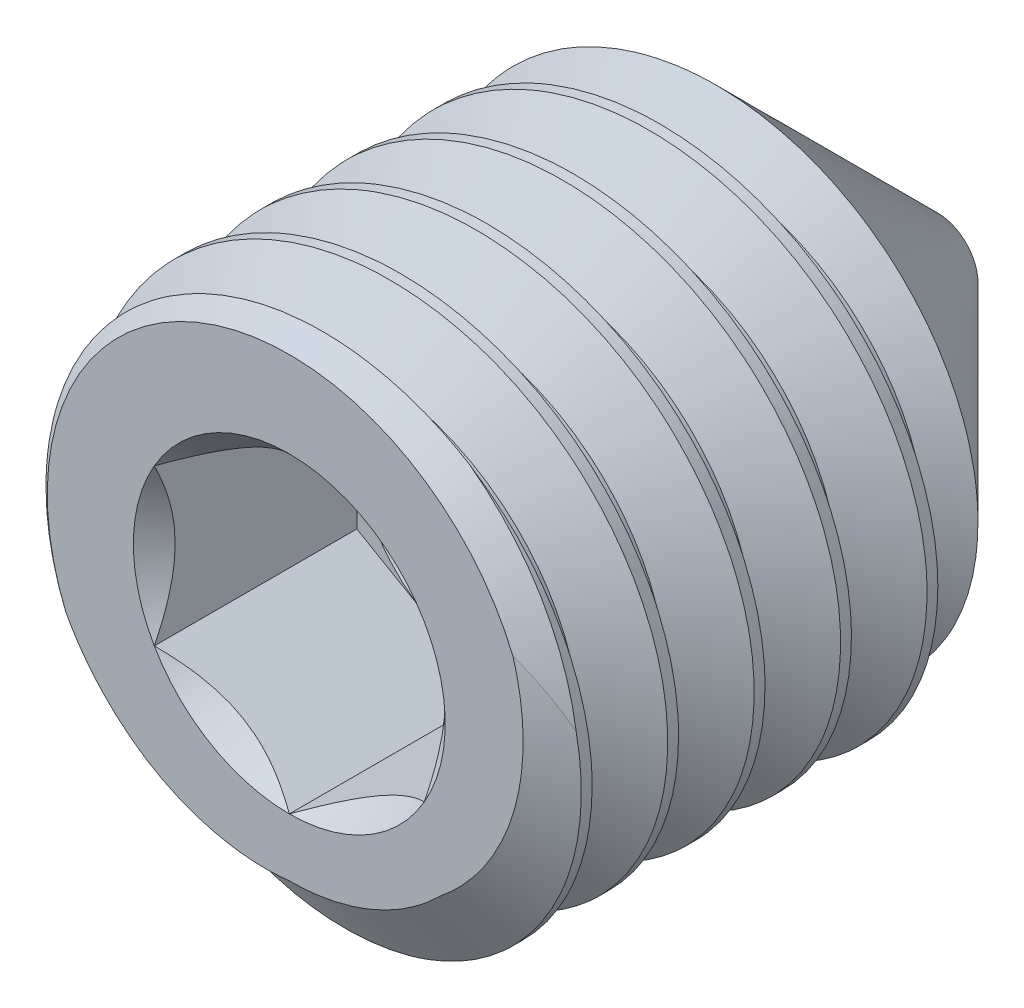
SolidWorks part; units mm, degrees
ref_plane "Front Plane" through (0, 0, 0) normal (0, 0, 1) x (1, 0, 0)
ref_plane "Top Plane" through (0, 0, 0) normal (0, 1, 0) x (1, 0, 0)
ref_plane "Right Plane" through (0, 0, 0) normal (1, 0, 0) x (0, 0, -1)
sketch "Sketch1" plane through (0, 0, 0) normal (1, 0, 0) x (0, 0, -1)
  line L0 (3, 0) -> (-3, 0) construction
  line L1 (0, -2.5) -> (0, 2.5) construction
  line L2 (3, 2.5) -> (-3, 2.5) construction
  line L3 (-3, 2.5) -> (-3, 0) construction
  line L4 (3, 0) -> (3, 2.5) construction
  line L5 (-3, -1.25) -> (-3, 1.25) construction
  line L6 (-3, 0) -> (-3, -2.5) construction
  line L7 (0.875, 2.5) -> (3, 0.375) construction
  line L8 (0.875, -2.5) -> (3, -0.375) construction
  line L9 (-3.75, 2.5866) -> (-2.95, 2.5866)
  line L10 (-2.95, 2.5866) -> (-3.35, 1.8938)
  line L11 (-3.35, 1.8938) -> (-3.75, 2.5866)
  line L12 (-3.35, 2.5866) -> (-3.35, 2.5)
  line L13 (-3.7, 2.5) -> (-3, 2.5)
  line L14 (-3.725, 2.5433) -> (-2.975, 2.5433)
  line L15 (-3.35, 1.9804) -> (-3.35, 1.8938)
  line L16 (-3.4, 1.9804) -> (-3.3, 1.9804)
  point P3 (-1.8, -2.5)
  point P4 (0, 0)
  point P8 (0, 0)
  point P11 (0, 2.5)
  point P14 (-3, 0)
  point P25 (-1.125, 0)
  point P27 (-3.35, 2.5)
  point P30 (-3.35, 2.5433)
  point P32 (-3.35, 1.9804)
sketch "Sketch2" plane through (0, 0, 0) normal (1, 0, 0) x (0, 0, -1)
  line L0 (-3, 2.2402) -> (-2.8181, 2.5)
  line L1 (-3, 2.5) -> (-3, 0) construction
  line L2 (3, 2.5) -> (-3, 2.5) construction
  line L3 (-2.8181, 2.5) -> (0.875, 2.5)
  line L4 (0.875, 2.5) -> (3, 0.375)
  line L7 (3, 0) -> (-3, 0)
  line L8 (-3, 0) -> (-3, 2.2402)
  line L9 (-3.15, 2.2402) -> (-3, 2.2402) construction
  line L10 (3, 0.375) -> (3, 0)
  line L11 (-2.95, 2.5866) -> (-3.35, 1.8938) construction
  dimension "D1" = 35
revolve "Revolve1" add sketch "Sketch2" angle 360 about L7
sketch "Sketch3" plane through (0, 0, 3) normal (0, 0, 1) x (1, 0, 0)
  line L1 (0, 1.4434) -> (-1.25, 0.7217)
  line L2 (-1.25, 0.7217) -> (-1.25, -0.7217)
  line L3 (-1.25, -0.7217) -> (0, -1.4434)
  line L4 (0, -1.4434) -> (1.25, -0.7217)
  line L5 (1.25, -0.7217) -> (1.25, 0.7217)
  line L6 (1.25, 0.7217) -> (0, 1.4434)
  circle A0 centre (0, 0) radius 1.25 construction
extrude "Cut-Extrude1" cut sketch "Sketch3" against normal up to vertex (1.875 mm away)
sketch "Sketch4" plane through (0, 0, 3) normal (0, 0, 1) x (1, 0, 0)
  circle A0 centre (0, 0) radius 1.4434
extrude "Cut-Extrude2" cut sketch "Sketch4" against normal blind 2.54 draft 45
sketch "Sketch5" plane through (0, 0, 1.125) normal (0, 0, 1) x (1, 0, 0)
  circle A0 centre (0, 0) radius 1.25 construction
  circle A1 centre (0, 0) radius 1.25
extrude "Cut-Extrude3" cut sketch "Sketch5" against normal through all draft 45
sketch "Sketch6" plane through (0, 0, 3) normal (0, 0, 1) x (1, 0, 0)
  circle A0 centre (0, 0) radius 2.5
curve "Helix/Spiral1"
sketch "Sketch7" plane through (0, 0, 0) normal (1, 0, 0) x (0, 0, -1)
  line L0 (-3.725, 2.5433) -> (-2.975, 2.5433)
  line L1 (-2.975, 2.5433) -> (-3.3, 1.9804)
  line L2 (-3.3, 1.9804) -> (-3.4, 1.9804)
  line L3 (-3.4, 1.9804) -> (-3.725, 2.5433)
sweep "Cut-Sweep1" cut profiles "Sketch7" path "Helix/Spiral1"
equation "\"Pitch/8@Sketch1\" = \"Thread Pitch@Sketch1\" / 8"
equation "\"Approx. Drive Depth@Sketch1\" = \"Drive Size@Sketch1\" * .75"
equation "\"D3@Helix/Spiral1\" = \"Length@Sketch1\" + \"Thread Pitch@Sketch1\""
equation "\"D4@Helix/Spiral1\" = \"Thread Pitch@Sketch1\""
equation "\"Thread Note@Sketch1\" = \"Thread Pitch@Sketch1\" * 1.5"
equation "\"Approx. Min OD@Sketch1\"=\"Thread Size@Sketch1\" *.15"
